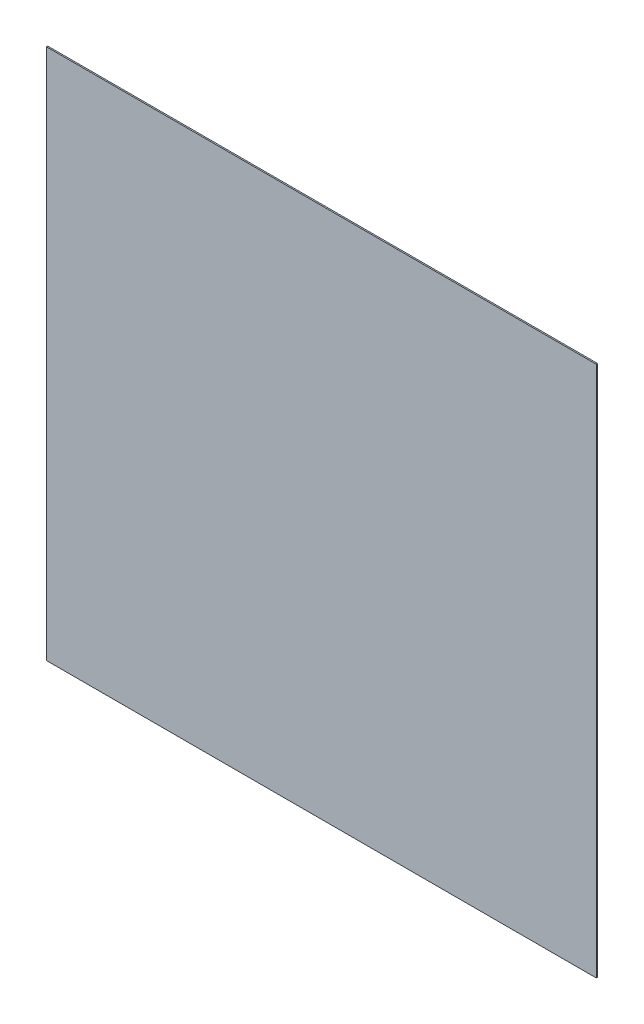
SolidWorks part; units mm, degrees
ref_plane "Plan de face" through (0, 0, 0) normal (0, 0, 1) x (1, 0, 0)
ref_plane "Plan de dessus" through (0, 0, 0) normal (0, 1, 0) x (1, 0, 0)
ref_plane "Plan de droite" through (0, 0, 0) normal (1, 0, 0) x (0, 0, -1)
sketch "Model" plane through (0, 0, 0) normal (0, 0, 1) x (1, 0, 0)
  line L0 (1032.3846, 654.3047) -> (822.3846, 654.3047)
  line L1 (822.3846, 654.3047) -> (822.3846, 464.3047)
  line L2 (822.3846, 464.3047) -> (1032.3846, 464.3047)
  line L3 (1032.3846, 464.3047) -> (1032.3846, 654.3047)
  line L4 (1302.0636, 362.1494) -> (1143.0636, 362.1494)
  line L5 (1143.0636, 362.1494) -> (1143.0636, 247.1494)
  line L6 (1143.0636, 247.1494) -> (1302.0636, 247.1494)
  line L7 (1302.0636, 247.1494) -> (1302.0636, 362.1494)
  line L8 (1290.7747, 654.3047) -> (1131.7747, 654.3047)
  line L9 (1131.7747, 654.3047) -> (1131.7747, 464.3047)
  line L10 (1131.7747, 464.3047) -> (1290.7747, 464.3047)
  line L11 (1290.7747, 464.3047) -> (1290.7747, 654.3047)
  line L12 (1023.1433, 413.8035) -> (813.1433, 413.8035)
  line L13 (813.1433, 413.8035) -> (813.1433, 211.8035)
  line L14 (813.1433, 211.8035) -> (1023.1433, 211.8035)
  line L15 (1023.1433, 211.8035) -> (1023.1433, 413.8035)
extrude "Boss.-Extru.1" add sketch "Model" along normal blind 0.5 contours L15 L12 L13 L14
sketch "Esquisse1" plane through (0, 0, 0.5) normal (0, 0, 1) x (1, 0, 0)
  line L0 (813.1433, 413.8035) -> (813.1433, 211.8035) construction
  line L1 (804.1884, 419.8188) -> (814.1433, 419.8188)
  line L2 (804.1884, 419.8188) -> (804.1884, 208.2769)
  line L3 (804.1884, 208.2769) -> (814.1433, 208.2769)
  line L4 (814.1433, 419.8188) -> (814.1433, 208.2769)
  dimension "D1" = 1
extrude "Enlèv. mat.-Extru.1" cut sketch "Esquisse1" against normal through all
